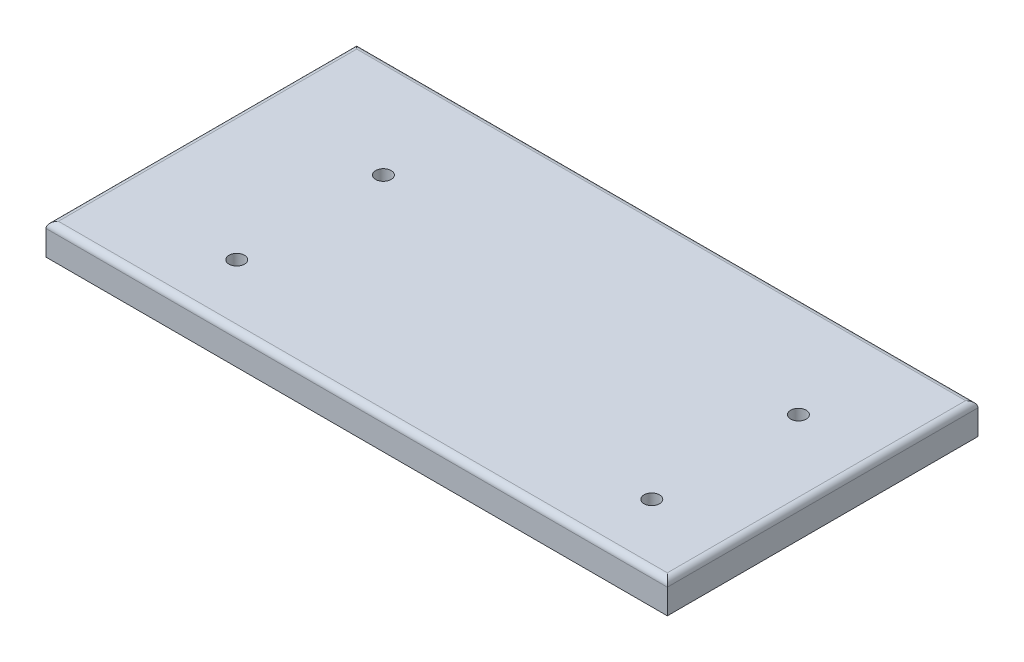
SolidWorks part; units mm, degrees
ref_plane "Front Plane" through (0, 0, 0) normal (0, 0, 1) x (1, 0, 0)
ref_plane "Top Plane" through (0, 0, 0) normal (0, 1, 0) x (1, 0, 0)
ref_plane "Right Plane" through (0, 0, 0) normal (1, 0, 0) x (0, 0, -1)
sketch "Sketch1" plane through (0, 0, 0) normal (0, 1, 0) x (1, 0, 0)
  line L1 (0, 0) -> (-254, 0)
  line L2 (0, 0) -> (0, 127)
  line L3 (0, 127) -> (-254, 127)
  line L4 (-254, 0) -> (-254, 127)
  dimension "D1" = 254
  dimension "D2" = 127
extrude "Extrude1" add sketch "Sketch1" along normal blind 12.7
fillet "Fillet1" radius 2.54 4 edges at (-127, 12.7, 0) (0, 12.7, -63.5) (-127, 12.7, -127) (-254, 12.7, -63.5)
hole_wizard " (0.25) Diameter Hole1" positions "Sketch3" profile "Sketch2" hole size "1/4" standard "Ansi Inch"
sketch "Sketch3" plane through (0, 12.7, 0) normal (0, 1, 0) x (-1, 0, 0)
  line L0 (0, 0) -> (254, 0) construction
  line L1 (0, -127) -> (0, 0) construction
  point P0 (201.422, -85.344)
  point P1 (31.75, -85.344)
  point P3 (31.75, -25.4)
  point P5 (201.422, -25.4)
  dimension "D1" = 59.944
  dimension "D2" = 169.672
  dimension "D3" = 25.4
  dimension "D4" = 31.75
sketch "Sketch2" plane through (-201.422, 12.7, -85.344) normal (1, 0, 0) x (0, 0, 1)
  line L0 (0, 0) -> (0, 27.3077)
  line L1 (0, 27.3077) -> (3.175, 25.4)
  line L2 (3.175, 25.4) -> (3.175, 0)
  line L5 (3.175, 0) -> (0, 0)
  line L10 (0, 27.3077) -> (-3.175, 25.4) construction
  line L11 (0, -6.35) -> (0, 107.95) construction
  dimension "Hole Dia." = 6.35
  dimension "Hole Depth" = 25.4
  dimension "Drill Angle" = 118
